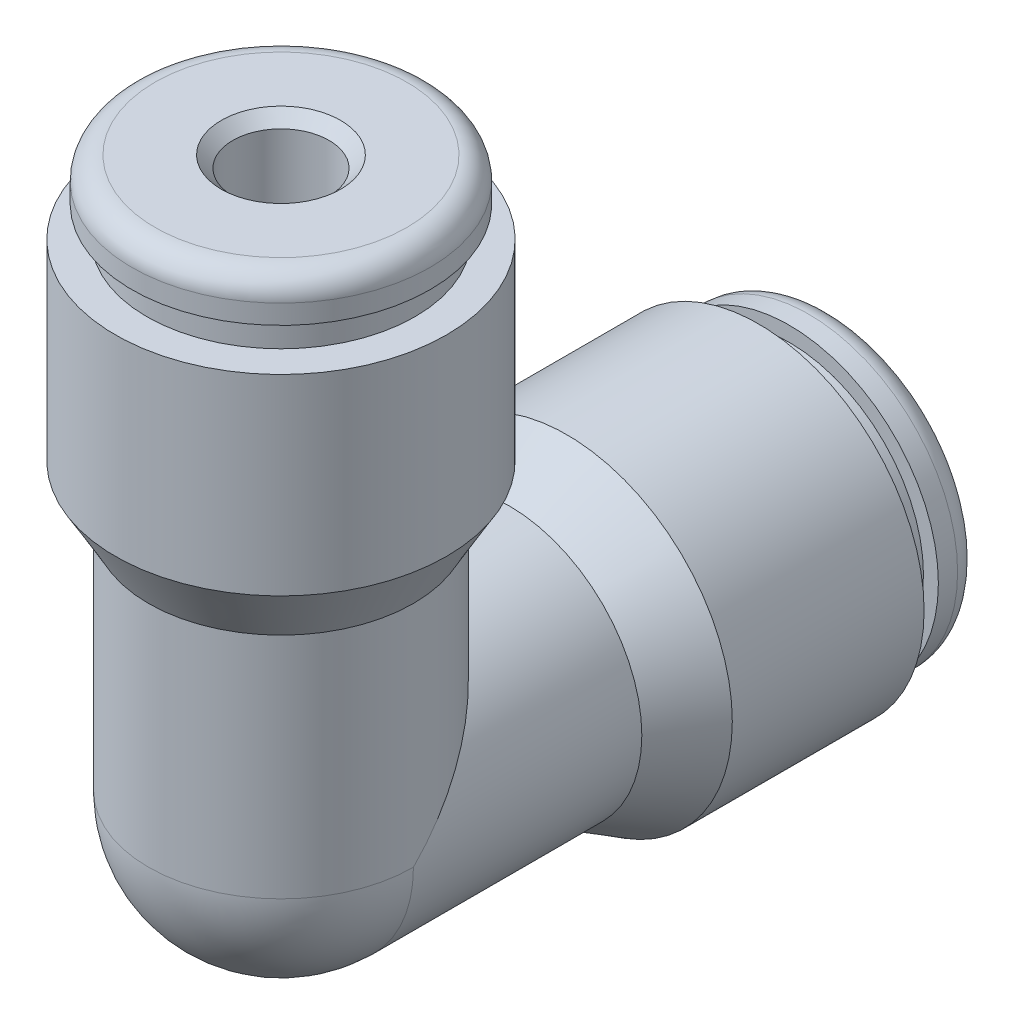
SolidWorks part; units mm, degrees
ref_plane "Front Plane" through (0, 0, 0) normal (0, 0, 1) x (1, 0, 0)
ref_plane "Top Plane" through (0, 0, 0) normal (0, 1, 0) x (1, 0, 0)
ref_plane "Right Plane" through (0, 0, 0) normal (1, 0, 0) x (0, 0, -1)
sketch "Sketch8" plane through (0, 0, 0) normal (1, 0, 0) x (0, 0, -1)
  line L0 (16.764, 4.9149) -> (17.399, 4.9149)
  line L1 (9.4228, 5.461) -> (15.748, 5.461)
  line L2 (0, 4.3688) -> (0, 3.175)
  line L3 (0, 3.175) -> (17.78, 3.175)
  line L4 (18.161, 4.1529) -> (18.161, 3.556)
  line L5 (0, 5.461) -> (0, -12.7) construction
  line L6 (15.748, 5.461) -> (15.748, 4.4234)
  line L7 (15.748, 4.4234) -> (16.764, 4.4234)
  line L8 (16.764, 4.9149) -> (16.764, 4.4234)
  line L9 (-5.461, -12.7) -> (5.461, -12.7) construction
  line L10 (0, 0) -> (18.161, 0) construction
  line L12 (17.78, 3.175) -> (18.161, 3.556)
  line L13 (0, 0) -> (0, 10.8701) construction
  line L14 (0, 4.3688) -> (7.5311, 4.3688)
  line L15 (7.5311, 4.3688) -> (9.4228, 5.461)
  arc A0 (17.399, 4.9149) -> (18.161, 4.1529) centre (17.399, 4.1529) cw
  point P1 (18.161, 3.175)
  point P20 (18.161, 4.9149)
  dimension "D4" = 0.762
  dimension "D1" = 1.397
  dimension "tube od" = 6.35
  dimension "D2" = 1.016
  dimension "D3" = 8.8468
  dimension "D5" = 10.6299
  dimension "G" = 10.922
  dimension "D6" = 9.8298
  dimension "D8" = 10.922
  dimension "L" = 23.622
  dimension "D9" = 30
  dimension "D10" = 8.7376
revolve "Revolve1" add sketch "Sketch8" angle 360 about L10
sketch "Sketch10" plane through (0, 0, 0) normal (0, 0, 1) x (1, 0, 0)
  line L0 (0, 0) -> (8.5418, 0) construction
sketch "Sketch9" plane through (0, 0, 0) normal (0, 0, 1) x (1, 0, 0)
  circle A0 centre (0, 0) radius 3.175 construction
  circle A1 centre (0, 0) radius 3.175
  circle A2 centre (0, 0) radius 2.413
  dimension "D1" = 0.762
extrude "Extrude1" add sketch "Sketch9" against normal blind 4.3688
ref_axis "Axis1" through (8.5418, 0, 0) along (-1, 0, 0)
pattern_circular "CirPattern2" count 2 over 90 about axis through (8.5418, 0, 0) along (-1, 0, 0)
sketch "Sketch12" plane through (0, 0, 0) normal (0, 1, 0) x (1, 0, 0)
  circle A0 centre (0, 0) radius 2.413
  circle A1 centre (0, 0) radius 2.413 construction
extrude "Cut-Extrude1" cut sketch "Sketch12" along normal through all
sketch "Sketch13" plane through (0, 0, 0) normal (0, 0, 1) x (1, 0, 0)
  circle A0 centre (0, 0) radius 2.413
  arc A1 (-2.413, 0) -> (2.413, 0) centre (0, 0) ccw construction
extrude "Cut-Extrude2" cut sketch "Sketch13" against normal through all
sketch "Sketch11" plane through (0, 0, 0) normal (0, 0, 1) x (1, 0, 0)
  line L0 (-4.3688, 0) -> (-2.413, 0)
  line L1 (-4.3688, 0) -> (-14.7876, 0) construction
  line L2 (2.413, 0) -> (4.3688, 0)
  arc A0 (-4.3688, 0) -> (4.3688, 0) centre (0, 0) ccw
  arc A1 (-2.413, 3.642) -> (2.413, 3.642) centre (0, 0) ccw construction
  arc A2 (-2.413, 0) -> (2.413, 0) centre (0, 0) ccw
  arc A3 (-2.413, 0) -> (2.413, 0) centre (0, 0) ccw construction
revolve "Revolve2" add sketch "Sketch11" angle 90 about L1
combine bodies "Combine1" operation type add bodies to combine 122 126
sketch "Sketch14" plane through (0, 4.3688, 0) normal (0, 1, 0) x (-1, 0, 0)
  circle A0 centre (0, 0) radius 3.556 construction
  circle A1 centre (0, 0) radius 3.556
  circle A2 centre (0, 0) radius 1.5875
  dimension "pipe od 2" = 3.175
sketch "Sketch15" plane through (0, 4.3688, 0) normal (0, 1, 0) x (-1, 0, 0)
  circle A1 centre (0, 0) radius 2.413 construction
  circle A2 centre (0, 0) radius 0.8255
  circle A3 centre (0, 0) radius 0.8255
  circle A4 centre (0, 0) radius 2.413
  dimension "D1" = 0.762
extrude "Extrude2" add sketch "Sketch15" against normal up to surface (1.9558 mm away)
extrude "Extrude3" add sketch "Sketch14" along normal up to surface (13.7922 mm away)
chamfer "Chamfer1" distance 0.381 angle 45 1 edges at (0, 18.161, -1.5875)
sketch "Sketch16" plane through (0, 0, -4.3688) normal (0, 0, -1) x (-1, 0, 0)
  circle A0 centre (0, 0) radius 2.413 construction
  circle A1 centre (0, 0) radius 2.413
equation "\"D6@Sketch8\" = \"G@Sketch8\"*.9"
equation "\"D3@Sketch8\" = \"D6@Sketch8\"*.9"
equation "\"D10@Sketch8\" = \"G@Sketch8\"*.8"
equation "\"D5@Sketch8\" = \"L@Sketch8\"*.45"
equation "\"D1@Extrude1\" = \"D10@Sketch8\"/2"
equation "\"D8@Sketch8\" = \"G@Sketch8\""
